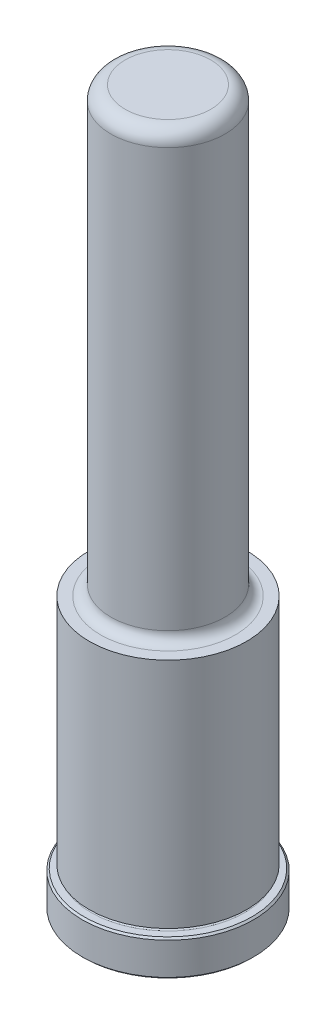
SolidWorks part; units mm, degrees
ref_plane "Front Plane" through (0, 0, 0) normal (0, 0, 1) x (1, 0, 0)
ref_plane "Top Plane" through (0, 0, 0) normal (0, 1, 0) x (1, 0, 0)
ref_plane "Right Plane" through (0, 0, 0) normal (1, 0, 0) x (0, 0, -1)
sketch "Sketch1" plane through (0, 0, 0) normal (1, 0, 0) x (0, 0, -1)
  line L0 (0, 0) -> (19.05, 0)
  line L1 (19.05, 0) -> (19.05, 7.9248)
  line L2 (19.05, 7.9248) -> (17.0688, 7.9248)
  line L3 (16.6878, 2.6782) -> (16.6878, 5.9795) construction
  line L4 (17.0688, 8.6868) -> (17.4752, 8.6868)
  line L5 (17.4752, 8.6868) -> (17.4752, 60.325)
  line L6 (17.4752, 60.325) -> (14.9733, 60.325)
  line L7 (12.6873, 62.611) -> (12.6873, 158.75)
  line L9 (12.6873, 158.75) -> (0, 158.75)
  line L10 (0, 158.75) -> (0, 0)
  line L11 (0, 0) -> (0, -7.2694) construction
  arc A0 (17.0688, 8.6868) -> (17.0688, 7.9248) centre (17.0688, 8.3058) ccw
  arc A1 (14.9733, 60.325) -> (12.6873, 62.611) centre (14.9733, 62.611) cw
  point P2 (12.6873, 158.75)
  point P14 (12.6873, 158.4124)
  point P19 (12.6873, 60.325)
  dimension "D14" = 0.762
  dimension "D8" = 2.286
  dimension "T" = 7.9248
  dimension "D2" = 0.762
  dimension "M" = 38.1
  dimension "B" = 34.9504
  dimension "L" = 158.75
  dimension "D7" = 0.7874
  dimension "A" = 60.325
  dimension "D" = 25.3746
  dimension "D15" = 98.425
revolve "Revolve1" add sketch "Sketch1" angle 360 about L11
chamfer "Chamfer1" distance 0.381 angle 45 2 edges at (0, 0, 19.05) (0, 7.9248, 19.05)
fillet "Fillet7" radius 3.175 1 edges at (0, 158.75, 12.6873)
